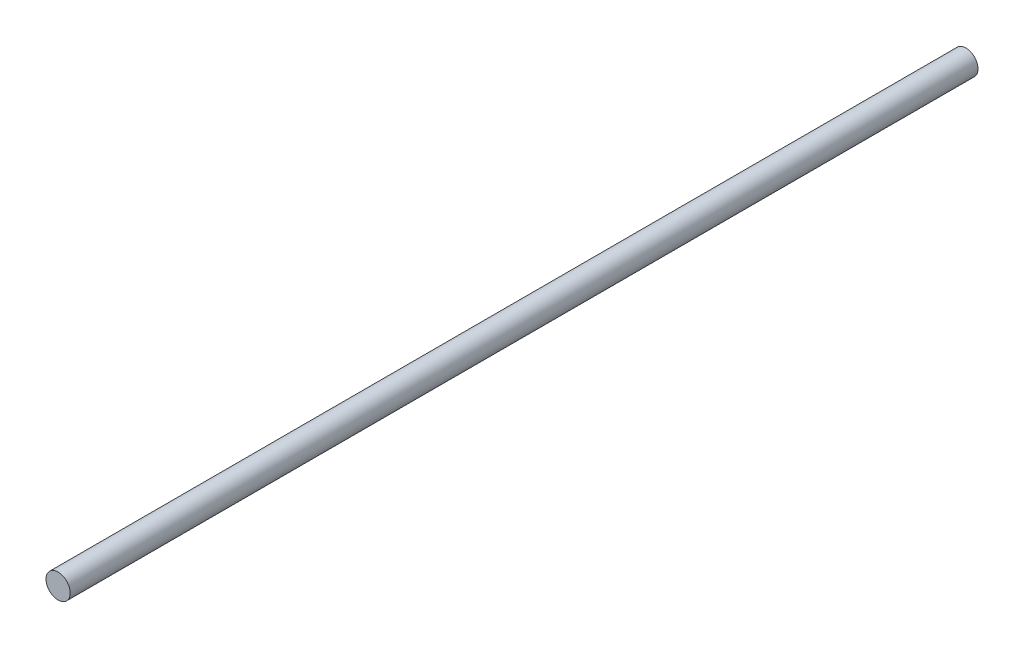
SolidWorks part; units mm, degrees
ref_plane "Alzado" through (0, 0, 0) normal (0, 0, 1) x (1, 0, 0)
ref_plane "Planta" through (0, 0, 0) normal (0, 1, 0) x (1, 0, 0)
ref_plane "Vista lateral" through (0, 0, 0) normal (1, 0, 0) x (0, 0, -1)
sketch "Sketch1" plane through (0, 0, 0) normal (0, 0, 1) x (1, 0, 0)
  circle A0 centre (0, 0) radius 4
  dimension "D1" = 8
extrude "Boss-Extrude1" add sketch "Sketch1" along normal mid plane 300
